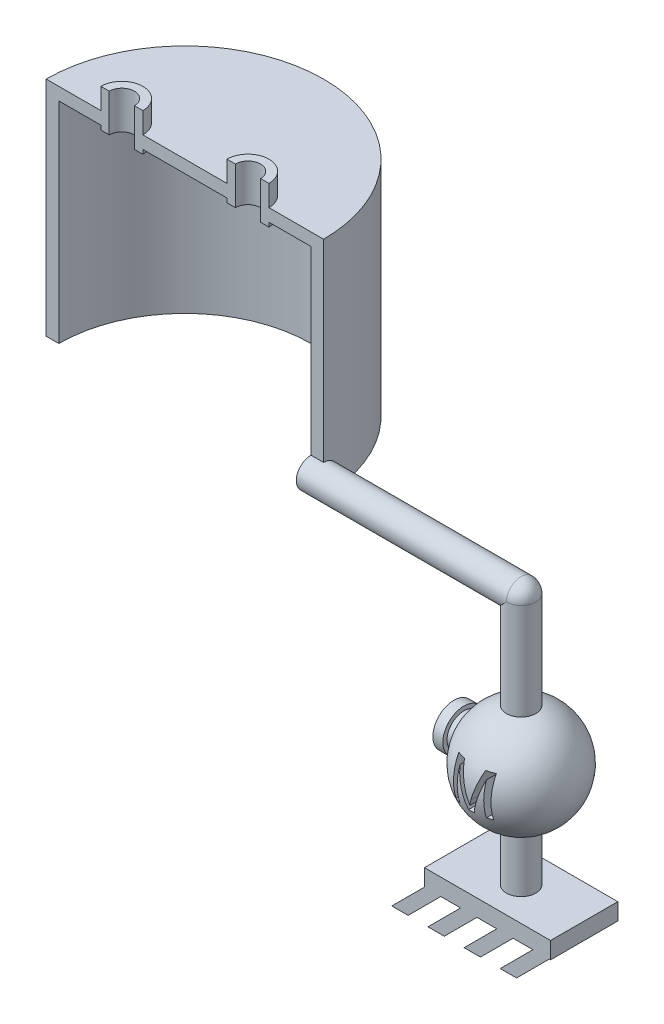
SolidWorks part; units mm, degrees
ref_plane "Face" through (0, 0, 0) normal (0, 0, 1) x (1, 0, 0)
ref_plane "Dessus" through (0, 0, 0) normal (0, 1, 0) x (1, 0, 0)
ref_plane "Droite" through (0, 0, 0) normal (1, 0, 0) x (0, 0, -1)
sketch "Esquisse1" plane through (0, 0, 0) normal (0, 0, 1) x (1, 0, 0)
  line L0 (16.0965, 0) -> (-26.8862, 0) construction
  line L1 (-11.8427, 4) -> (-13.6239, 4)
  line L2 (-13.6239, 4) -> (-13.6239, 5)
  line L3 (-13.6239, 5) -> (-16, 5)
  line L4 (-16, 5) -> (-16, 0)
  line L5 (-16, 0) -> (12.5, 0)
  arc A0 (12.5, 0) -> (-11.8427, 4) centre (0, 0) ccw
  dimension "D1" = 25
  dimension "D2" = 4
  dimension "D3" = 5
  dimension "D4" = 16
revolve "Révolution1" add sketch "Esquisse1" angle 360 about L0
sketch "Esquisse2" plane through (0, 0, 0) normal (0, 0, 1) x (1, 0, 0)
  text T0 "M" font "Arial" height in points 36
extrude "Enlèv. mat.-Extru.1" cut sketch "Esquisse2" along normal blind 16.1277
sketch "Esquisse3" plane through (0, 0, 0) normal (0, 1, 0) x (1, 0, 0)
  circle A0 centre (0, 0) radius 3.5
  dimension "D1" = 7
extrude "Extrusion1" add sketch "Esquisse3" against normal blind 25
sketch "Esquisse4" plane through (0, 0, 0) normal (0, 1, 0) x (1, 0, 0)
  circle A0 centre (0, 0) radius 3.5
  dimension "D1" = 7
extrude "Extrusion2" add sketch "Esquisse4" along normal blind 35
sketch "Esquisse5" plane through (0, 0, 0) normal (1, 0, 0) x (0, 0, -1)
  line L0 (3.5, 35) -> (-3.5, 35) construction
  line L1 (3.5, 12) -> (3.5, 35) construction
  circle A0 centre (0, 35) radius 3.5
extrude "Extrusion3" add sketch "Esquisse5" against normal blind 50
sketch "Esquisse6" plane through (0, 0, 0) normal (0, 0, 1) x (1, 0, 0)
  line L0 (-80, 79.0904) -> (-80, -33.1481) construction
  line L2 (-50, 31.5) -> (-47, 31.5)
  line L3 (-50, 31.5) -> (-50, 81.5)
  line L4 (-50, 84.5) -> (-47, 84.5)
  line L5 (-47, 31.5) -> (-47, 84.5)
  line L6 (-50, 84.5) -> (-80, 84.5)
  line L8 (-50, 81.5) -> (-80, 81.5)
  line L9 (-80, 84.5) -> (-80, 81.5)
  dimension "D1" = 80
  dimension "D2" = 3
  dimension "D3" = 3
  dimension "D4" = 50
revolve "Révolution3" add sketch "Esquisse6" angle 180 about L0
sketch "Esquisse7" plane through (0, 84.5, 0) normal (0, 1, 0) x (-1, 0, 0)
  line L0 (113, 0) -> (47, 0) construction
  line L1 (100, 0) -> (90, 0)
  line L2 (70, 0) -> (60, 0)
  arc A0 (60, 0) -> (70, 0) centre (65, 0) ccw
  arc A1 (90, 0) -> (100, 0) centre (95, 0) ccw
  point P6 (80, 0)
  point P7 (80, 0)
  dimension "D1" = 10
  dimension "D2" = 15
  dimension "D3" = 15
extrude "Extrusion4" add sketch "Esquisse7" along normal blind 5 and the other way blind 4
sketch "Esquisse9" plane through (0, 89.5, 0) normal (0, 1, 0) x (-1, 0, 0)
  line L0 (70, 0) -> (60, 0) construction
  line L1 (100, 0) -> (90, 0) construction
  circle A0 centre (65, 0) radius 3
  circle A1 centre (95, 0) radius 3
  dimension "D1" = 6
extrude "Enlèv. mat.-Extru.2" cut sketch "Esquisse9" against normal blind 17
sketch "Esquisse10" plane through (0, -25, 0) normal (0, -1, 0) x (1, 0, 0)
  line L1 (15, 8) -> (-15, 8)
  line L2 (15, 8) -> (15, -8)
  line L3 (15, -8) -> (-15, -8)
  line L4 (-15, 8) -> (-15, -8)
  dimension "D1" = 30
  dimension "D2" = 15
  dimension "D3" = 16
  dimension "D4" = 8
extrude "Extrusion5" add sketch "Esquisse10" along normal blind 4
sketch "Esquisse11" plane through (0, 0, 8) normal (0, 0, 1) x (1, 0, 0)
  line L0 (-15, -29) -> (-22.7764, -36.7764)
  line L1 (-22.7764, -36.7764) -> (-18.8882, -36.7764)
  line L2 (-18.8882, -36.7764) -> (-11.1118, -29)
  line L3 (15, -29) -> (-15, -29) construction
  line L4 (-11.1118, -29) -> (-15, -29)
  line L5 (-2.5118, -29) -> (-6.4, -29)
  line L6 (-10.2882, -36.7764) -> (-2.5118, -29)
  line L7 (-6.4, -29) -> (-14.1764, -36.7764)
  line L8 (-14.1764, -36.7764) -> (-10.2882, -36.7764)
  line L9 (6.0882, -29) -> (2.2, -29)
  line L10 (-1.6882, -36.7764) -> (6.0882, -29)
  line L11 (2.2, -29) -> (-5.5764, -36.7764)
  line L12 (-5.5764, -36.7764) -> (-1.6882, -36.7764)
  line L13 (14.6882, -29) -> (10.8, -29)
  line L14 (6.9118, -36.7764) -> (14.6882, -29)
  line L15 (10.8, -29) -> (3.0236, -36.7764)
  line L16 (3.0236, -36.7764) -> (6.9118, -36.7764)
extrude "Extrusion6" add sketch "Esquisse11" against normal up to surface (16 mm away)
sketch "Esquisse12" plane through (0, 35, 0) normal (0, 1, 0) x (-1, 0, 0)
  line L0 (0, -12.7249) -> (0, 19.5471) construction
  line L1 (0, -3.5) -> (0, 3.5)
  line L2 (0, -3.5) -> (0, 3.5)
  arc A1 (0, 3.5) -> (0, -3.5) centre (0, 0) ccw
  arc A2 (0, 3.5) -> (0, -3.5) centre (0, 0) ccw
  dimension "D1" = 0
revolve "Révolution4" add sketch "Esquisse12" angle 360 about L0
